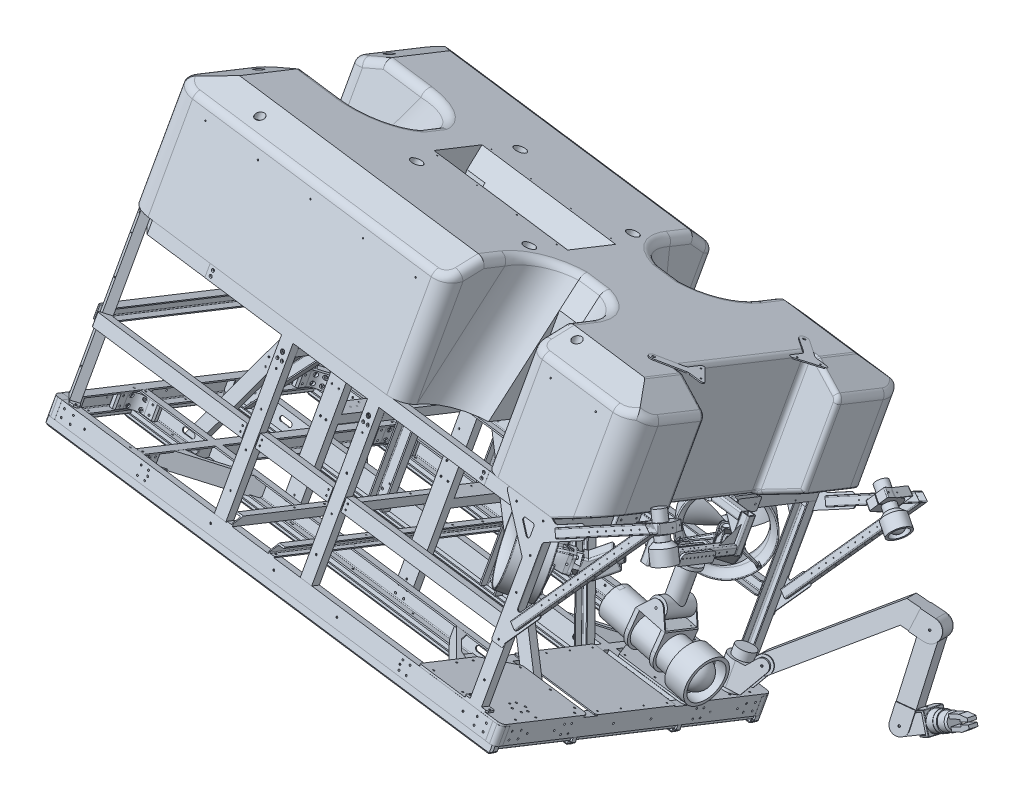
SolidWorks part; units mm, degrees
ref_plane "Front Plane" through (0, 0, 0) normal (0, 0, 1) x (1, 0, 0)
ref_plane "Top Plane" through (0, 0, 0) normal (0, 1, 0) x (1, 0, 0)
ref_plane "Right Plane" through (0, 0, 0) normal (1, 0, 0) x (0, 0, -1)
imported_body "MBARI ROV #1-1/HTE 380_Cust-1-surface1"
imported_body "MBARI ROV #1-1/HTE 380_Cust-1-surface2"
imported_body "MBARI ROV #1-1/HTE 380_Cust-1-surface3"
imported_body "MBARI ROV #1-1/HTE 380_Cust-1-surface4"
imported_body "MBARI ROV #1-1/HTE 380_Cust-1-surface5"
imported_body "MBARI ROV #1-1/HTE 380_Cust-1-surface6"
imported_body "MBARI ROV #1-1/HTE 380_Cust-1-surface7"
imported_body "MBARI ROV #1-1/HTE 380_Cust-1-surface8"
imported_body "MBARI ROV #1-1/HTE 380_Cust-1-surface9"
imported_body "MBARI ROV #1-1/HTE 380_Cust-1-surface10"
imported_body "MBARI ROV #1-1/HTE 380_Cust-1-surface11"
imported_body "MBARI ROV #1-1/HTE 380_Cust-1-surface12"
imported_body "MBARI ROV #1-1/HTE 380_Cust-1-surface13"
imported_body "MBARI ROV #1-1/HTE 380_Cust-1-surface14"
imported_body "MBARI ROV #1-1/HTE 380_Cust-1-surface15"
imported_body "MBARI ROV #1-1/HTE 380_Cust-1-surface16"
imported_body "MBARI ROV #1-1/HTE 380_Cust-1-surface17"
imported_body "MBARI ROV #1-1/HTE 380_Cust-1-surface18"
imported_body "MBARI ROV #1-1/HTE 380_Cust-1-surface19"
imported_body "MBARI ROV #1-1/HTE 380_Cust-1-surface20"
imported_body "MBARI ROV #1-1/HTE 380_Cust-1-surface21"
imported_body "MBARI ROV #1-1/HTE 380_Cust-2-surface1"
imported_body "MBARI ROV #1-1/HTE 380_Cust-2-surface2"
imported_body "MBARI ROV #1-1/HTE 380_Cust-2-surface3"
imported_body "MBARI ROV #1-1/HTE 380_Cust-2-surface4"
imported_body "MBARI ROV #1-1/HTE 380_Cust-2-surface5"
imported_body "MBARI ROV #1-1/HTE 380_Cust-2-surface6"
imported_body "MBARI ROV #1-1/HTE 380_Cust-2-surface7"
imported_body "MBARI ROV #1-1/HTE 380_Cust-2-surface8"
imported_body "MBARI ROV #1-1/HTE 380_Cust-2-surface9"
imported_body "MBARI ROV #1-1/HTE 380_Cust-2-surface10"
imported_body "MBARI ROV #1-1/HTE 380_Cust-2-surface11"
imported_body "MBARI ROV #1-1/HTE 380_Cust-2-surface12"
imported_body "MBARI ROV #1-1/HTE 380_Cust-2-surface13"
imported_body "MBARI ROV #1-1/HTE 380_Cust-2-surface14"
imported_body "MBARI ROV #1-1/HTE 380_Cust-2-surface15"
imported_body "MBARI ROV #1-1/HTE 380_Cust-2-surface16"
imported_body "MBARI ROV #1-1/HTE 380_Cust-2-surface17"
imported_body "MBARI ROV #1-1/buoyancy derived-1-surface1"
imported_body "MBARI ROV #1-1/chassis derived_1-1-surface1"
imported_body "MBARI ROV #1-1/chassis derived_1-1-surface2"
imported_body "MBARI ROV #1-1/chassis derived_1-1-surface3"
imported_body "MBARI ROV #1-1/chassis derived_1-1-surface4"
imported_body "MBARI ROV #1-1/chassis derived_1-1-surface5"
imported_body "MBARI ROV #1-1/chassis derived_1-1-surface6"
imported_body "MBARI ROV #1-1/chassis derived_1-1-surface7"
imported_body "MBARI ROV #1-1/chassis derived_1-1-surface8"
imported_body "MBARI ROV #1-1/chassis derived_1-1-surface9"
imported_body "MBARI ROV #1-1/chassis derived_1-1-surface10"
imported_body "MBARI ROV #1-1/chassis derived_1-1-surface11"
imported_body "MBARI ROV #1-1/chassis derived_1-1-surface12"
imported_body "MBARI ROV #1-1/chassis derived_1-1-surface13"
imported_body "MBARI ROV #1-1/chassis derived_1-1-surface14"
imported_body "MBARI ROV #1-1/chassis derived_1-1-surface15"
imported_body "MBARI ROV #1-1/chassis derived_1-1-surface16"
imported_body "MBARI ROV #1-1/chassis derived_1-1-surface17"
imported_body "MBARI ROV #1-1/chassis derived_1-1-surface18"
imported_body "MBARI ROV #1-1/chassis derived_1-1-surface19"
imported_body "MBARI ROV #1-1/chassis derived_1-1-surface20"
imported_body "MBARI ROV #1-1/chassis derived_1-1-surface21"
imported_body "MBARI ROV #1-1/chassis derived_1-1-surface22"
imported_body "MBARI ROV #1-1/chassis derived_1-1-surface23"
imported_body "MBARI ROV #1-1/chassis derived_1-1-surface24"
imported_body "MBARI ROV #1-1/chassis derived_1-1-surface25"
imported_body "MBARI ROV #1-1/chassis derived_1-1-surface26"
imported_body "MBARI ROV #1-1/chassis derived_1-1-surface27"
imported_body "MBARI ROV #1-1/chassis derived_1-1-surface28"
imported_body "MBARI ROV #1-1/chassis derived_1-1-surface29"
imported_body "MBARI ROV #1-1/chassis derived_1-1-surface30"
imported_body "MBARI ROV #1-1/chassis derived_1-1-surface31"
imported_body "MBARI ROV #1-1/chassis derived_1-1-surface32"
imported_body "MBARI ROV #1-1/chassis derived_1-1-surface33"
imported_body "MBARI ROV #1-1/chassis derived_1-1-surface34"
imported_body "MBARI ROV #1-1/chassis derived_1-1-surface35"
imported_body "MBARI ROV #1-1/chassis derived_1-1-surface36"
imported_body "MBARI ROV #1-1/chassis derived_1-1-surface37"
imported_body "MBARI ROV #1-1/chassis derived_1-1-surface38"
imported_body "MBARI ROV #1-1/chassis derived_1-1-surface39"
imported_body "MBARI ROV #1-1/chassis derived_1-1-surface40"
imported_body "MBARI ROV #1-1/chassis derived_1-1-surface41"
imported_body "MBARI ROV #1-1/chassis derived_1-1-surface42"
imported_body "MBARI ROV #1-1/chassis derived_1-1-surface43"
imported_body "MBARI ROV #1-1/chassis derived_1-1-surface44"
imported_body "MBARI ROV #1-1/chassis derived_1-1-surface45"
imported_body "MBARI ROV #1-1/UPPER MTG PLATE-3-surface1"
imported_body "MBARI ROV #1-1/UPPER MTG PLATE-4-surface1"
imported_body "MBARI ROV #1-1/UPPER STRUT-1-surface1"
imported_body "MBARI ROV #1-1/UPPER STRUT-2-surface1"
imported_body "MBARI ROV #1-1/UPPER FRAME MTG PLATE-3-surface1"
imported_body "MBARI ROV #1-1/UPPER FRAME MTG PLATE-4-surface1"
imported_body "MBARI ROV #1-1/UPPER FRAME MTG TAB-3-surface1"
imported_body "MBARI ROV #1-1/UPPER FRAME MTG TAB-4-surface1"
imported_body "MBARI ROV #1-1/TOP MTG-5-surface1"
imported_body "MBARI ROV #1-1/TOP MTG-6-surface1"
imported_body "MBARI ROV #1-1/LOWER STRUT-1-surface1"
imported_body "MBARI ROV #1-1/LOWER STRUT-2-surface1"
imported_body "HDTV HANGER-1/HDTV HANGER BRKT-1-surface1"
imported_body "HDTV HANGER-1/HANGER DOWN TUBE-1-surface1"
imported_body "HDTV HANGER-1/HANGER DOWN TUBE-2-surface1"
imported_body "HDTV HANGER-1/HANGER CROSS TUBE-2-surface1"
imported_body "HDTV HANGER-1/HDTV HANGER BRKT-2-surface1"
imported_body "HDTV HANGER-1/GUSSET-1-surface1"
imported_body "HDTV HANGER-1/GUSSET-2-surface1"
imported_body "HDTV HANGER-1/HDTV STRUT-1-surface1"
imported_body "HDTV HANGER-1/HDTV STRUT-2-surface1"
imported_body "HDTV HANGER-1/GUSSET-3-surface1"
imported_body "HDTV HANGER-1/GUSSET-4-surface1"
imported_body "HD CAMERA-1/MOUNT-1-surface1"
imported_body "HD CAMERA-1/MOUNT-2-surface1"
imported_body "HD CAMERA-1/PT-25-1/PT25 STAND OFF-1-surface1"
imported_body "HD CAMERA-1/PT-25-1/U BRKT-1-surface1"
imported_body "HD CAMERA-1/PT-25-1/JOURNAL-3-surface1"
imported_body "HD CAMERA-1/HD CAMERA-1-surface1"
imported_body "HD CAMERA-1/END CAP-1-surface1"
imported_body "TitanII.ARM.Assy-1/Base 1-1-surface1"
imported_body "TitanII.ARM.Assy-1/Shoulder 2-1-surface1"
imported_body "TitanII.ARM.Assy-1/Forearm 3-2-surface1"
imported_body "TitanII.ARM.Assy-1/Wrist 4-1-surface1"
imported_body "TitanII.ARM.Assy-1/Yaw-1-surface1"
imported_body "GRAB-1/Grab Plate-1-surface1"
imported_body "HMI-4/HMI LIGHT-1-surface1"
imported_body "HMI-4/HMI MOUNT-1-surface1"
imported_body "HMI-4/HMI U BRACKET-1-surface1"
imported_body "HMI-5/HMI LIGHT-1-surface1"
imported_body "HMI-5/HMI LIGHT-1-surface2"
imported_body "HMI-5/HMI MOUNT-1-surface1"
imported_body "HMI-5/HMI U BRACKET-1-surface1"
surface "Surface-Loft4"
surface "Surface-Fill1"
